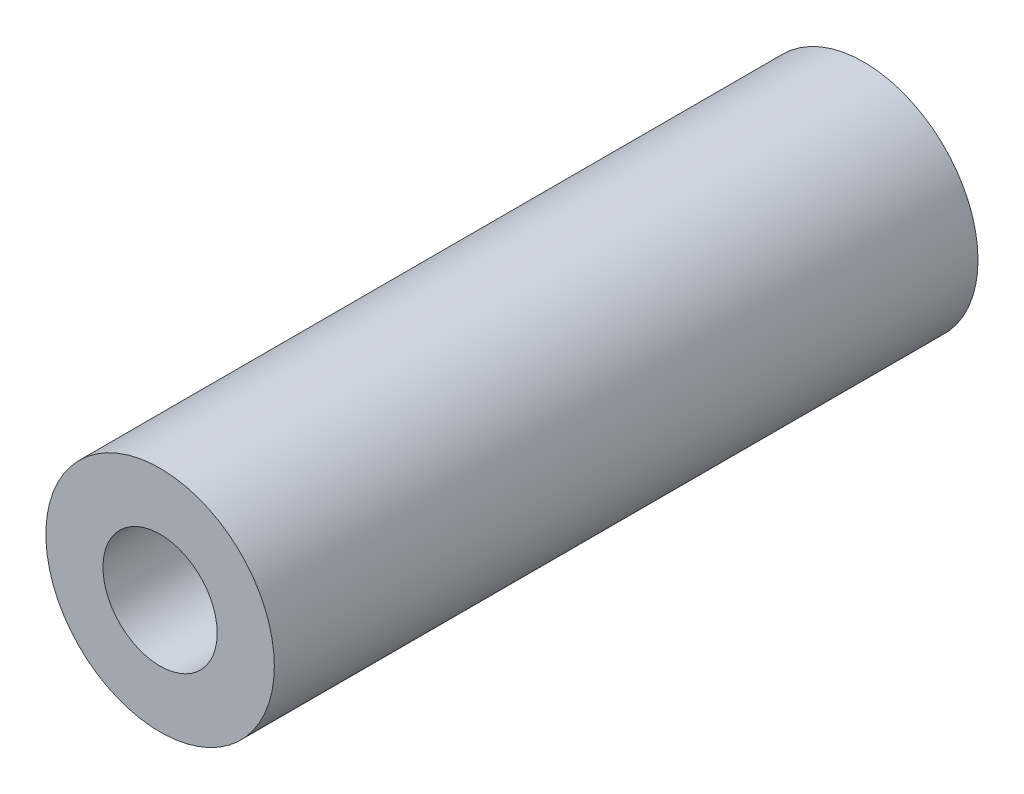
SolidWorks part; units mm, degrees
ref_plane "Face" through (0, 0, 0) normal (0, 0, 1) x (1, 0, 0)
ref_plane "Dessus" through (0, 0, 0) normal (0, 1, 0) x (1, 0, 0)
ref_plane "Droite" through (0, 0, 0) normal (1, 0, 0) x (0, 0, -1)
sketch "Esquisse1" plane through (0, 0, 0) normal (0, 0, 1) x (1, 0, 0)
  circle A0 centre (0, 0) radius 12.5
  circle A1 centre (0, 0) radius 6.25
  dimension "D1" = 25
  dimension "D2" = 12.5
extrude "69.8 long 77" add sketch "Esquisse1" along normal mid plane 77
